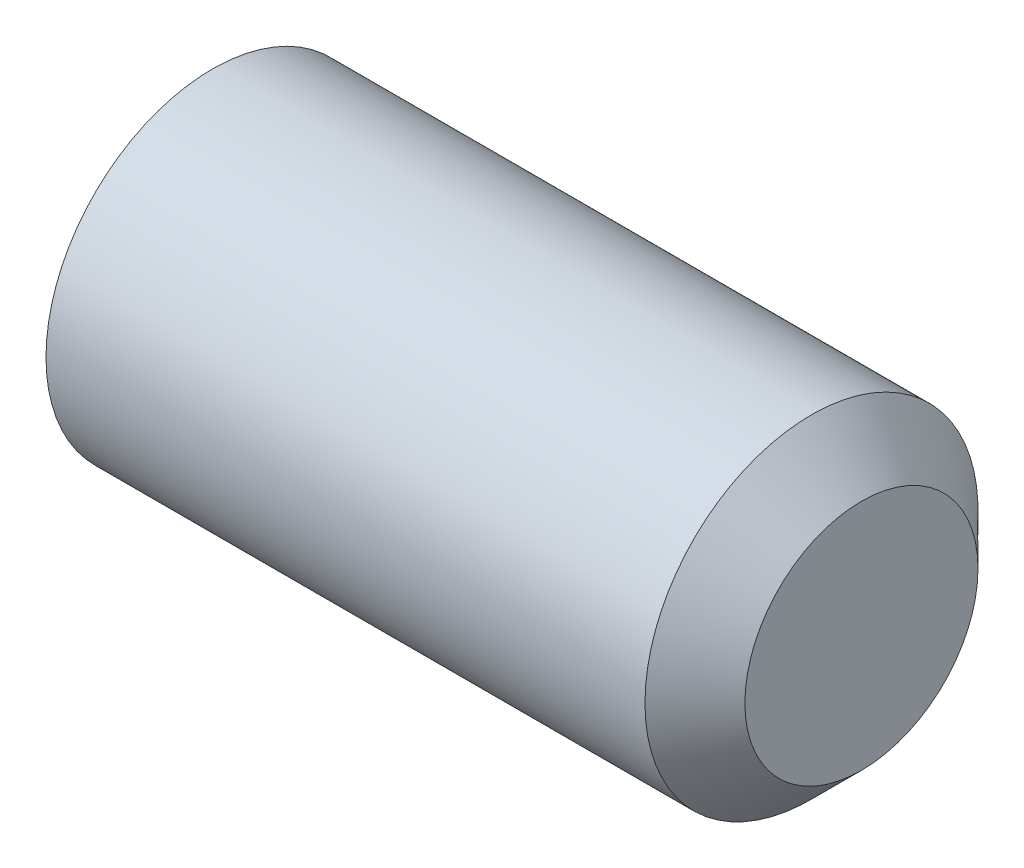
SolidWorks part; units mm, degrees
ref_plane "Plane1" through (0, 0, 0) normal (0, 0, 1) x (1, 0, 0)
ref_plane "Plane2" through (0, 0, 0) normal (0, 1, 0) x (1, 0, 0)
ref_plane "Plane3" through (0, 0, 0) normal (1, 0, 0) x (0, 0, -1)
sketch "BodySke" plane through (0, 0, 0) normal (0, 0, 1) x (1, 0, 0)
  line L0 (0, 0) -> (0, 2.055)
  line L1 (0, 2.055) -> (0.2569, 2.5)
  line L2 (0.2569, 2.5) -> (9.25, 2.5)
  line L3 (9.25, 2.5) -> (10, 1.75)
  line L4 (10, 0) -> (0, 0)
  line L5 (-12.7, 0) -> (88.9, 0) construction
  line L6 (10, 1.75) -> (10, 0)
  line L7 (10, 1.75) -> (10, 11.275) construction
  line L8 (0, -2.055) -> (0.2569, -2.5) construction
  line L9 (0.8, 15.875) -> (0.8, -3.175) construction
  line L10 (9.25, -2.5) -> (10, -1.75) construction
  dimension "Length" = 10
  dimension "Diameter" = 5
  dimension "Drive_ch_ang" = 60
  dimension "Minor_dia" = 4.11
  dimension "Cup_nose_ang" = 45
  dimension "Cup_dia" = 3.5
  dimension "Advance" = 0.8
revolve "BaseBody" add sketch "BodySke" angle 360 about L5
sketch "Sketch2" plane through (0, 0, 0) normal (-1, 0, 0) x (0, 0, 1)
  line L0 (0.7217, 1.25) -> (-0.7217, 1.25)
  line L1 (-0.7217, 1.25) -> (-1.4434, 0)
  line L2 (0.7217, 1.25) -> (1.4434, 0)
  line L3 (0.7217, -1.25) -> (1.4434, 0)
  line L4 (0.7217, -1.25) -> (-0.7217, -1.25)
  line L5 (-0.7217, -1.25) -> (-1.4434, 0)
  dimension "Hex_size" = 2.5
  dimension "D2" = 1.25
  dimension "D3" = 1.25
extrude "Hex" cut sketch "Sketch2" against normal blind 3
sketch "ThdSchSke" plane through (0, 0, 0) normal (0, 0, 1) x (1, 0, 0)
  line L0 (0.2569, -2.055) -> (-0.0547, -2.5)
  line L1 (0.2569, -2.055) -> (0.5685, -2.5)
  line L2 (0.5685, -2.5) -> (0.5685, -3.125)
  line L3 (-3.175, 0) -> (5.1513, 0) construction
  line L5 (0.5685, -3.125) -> (-0.0547, -3.125)
  line L6 (-0.0547, -3.125) -> (-0.0547, -2.5)
  line L8 (0.2569, 2.5) -> (0.2569, -2.5) construction
  dimension "Thread_minor" = 4.11
  dimension "Diameter" = 5
  dimension "SideAngle" = 55
  dimension "VeeAngle" = 70
  dimension "Overcut" = 6.25
revolve "ThreadSchematic" [suppressed] cut sketch "ThdSchSke" angle 360 about L3
pattern_linear "ThdSchPat" [suppressed]
equation "\"D2@Sketch2\" = \"Hex_size@Sketch2\" / 2"
equation "\"D3@Sketch2\" = \"Hex_size@Sketch2\" / 2"
equation "\"Thread_minor@ThreadCosmetic\" = \"Minor_dia@BodySke\""
equation "\"Thread_minor@ThdSchSke\" = \"Thread_minor@ThreadCosmetic\""
equation "\"Diameter@ThdSchSke\" = \"Diameter@BodySke\""
equation "\"Overcut@ThdSchSke\" = \"Diameter@BodySke\" * 1.25"
equation "\"Num_threads@ThdSchPat\" = int( (\"Length@BodySke\" - ( ( ( \"Diameter@BodySke\" - \"Minor_dia@BodySke\" ) * 0.5 ) / tan( \"Drive_ch_ang@BodySke\" * 0.017453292 ) ) - ( ( ( \"Diameter@BodySke\" - \"Cup_dia@BodySk"
equation "\"Advance@ThdSchPat\" = (\"Length@BodySke\" - ( ( ( \"Diameter@BodySke\" - \"Minor_dia@BodySke\" ) * 0.5 ) / tan( \"Drive_ch_ang@BodySke\" * 0.017453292 ) ) - ( ( ( \"Diameter@BodySke\" - \"Cup_dia@BodySke\" ) * 0."
equation "' \"Num_threads@ThdSchPat\" = \"Num_threads@ThdSchPat\" - sgn( \"Num_threads@ThdSchPat\" - 1) '---chamfered tips only---"
